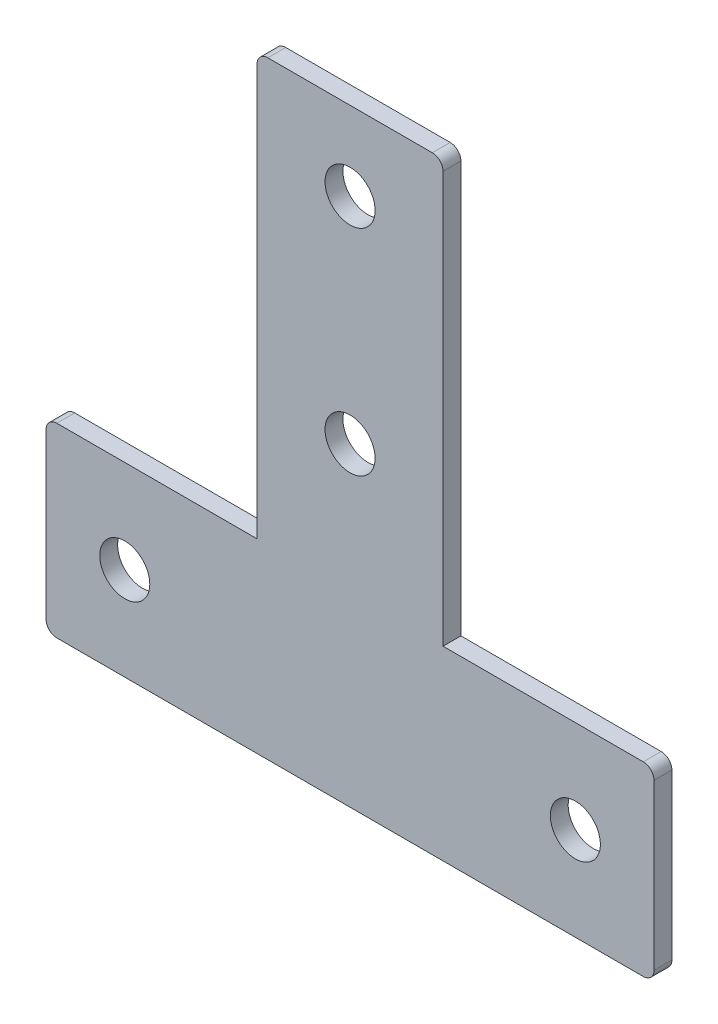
SolidWorks part; units mm, degrees
ref_plane "前视基准面" through (0, 0, 0) normal (0, 0, 1) x (1, 0, 0)
ref_plane "上视基准面" through (0, 0, 0) normal (0, 1, 0) x (1, 0, 0)
ref_plane "右视基准面" through (0, 0, 0) normal (1, 0, 0) x (0, 0, -1)
sketch "草图1" plane through (0, 0, 0) normal (0, 0, 1) x (1, 0, 0)
  line L0 (-42.5, 0) -> (-42.5, 26)
  line L1 (-42.5, 26) -> (-13, 26)
  line L2 (-13, 26) -> (-13, 85)
  line L3 (-13, 85) -> (13, 85)
  line L4 (13, 85) -> (13, 26)
  line L5 (13, 26) -> (42.5, 26)
  line L6 (42.5, 26) -> (42.5, 0)
  line L7 (42.5, 0) -> (-42.5, 0)
  circle A0 centre (0, 74) radius 3.5
  circle A1 centre (0, 44) radius 3.5
  circle A2 centre (-31.5, 13) radius 3.5
  circle A3 centre (31.5, 13) radius 3.5
  dimension "D8" = 7
  dimension "D9" = 11
  dimension "D11" = 11
  dimension "D12" = 30
  dimension "D1" = 29.5
  dimension "D2" = 26
  dimension "D3" = 85
  dimension "D4" = 26
  dimension "D5" = 29.5
  dimension "D6" = 59
  dimension "D7" = 42.5
  dimension "D10" = 11
extrude "凸台-拉伸2" add sketch "草图1" along normal mid plane 2.5
fillet "圆角1" radius 1.5 6 edges at (13, 85, 0) (-13, 85, 0) (42.5, 26, 0) (42.5, 0, 0) (-42.5, 0, 0) (-42.5, 26, 0)
